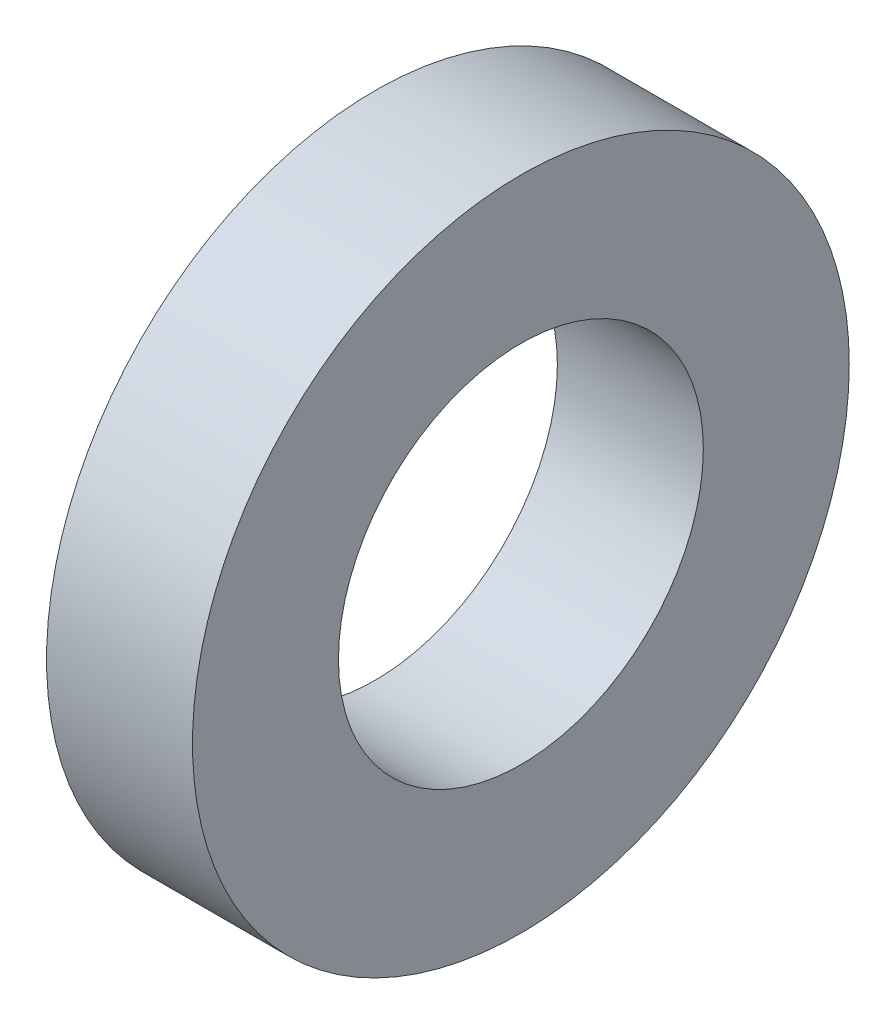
SolidWorks part; units mm, degrees
ref_plane "Face" through (0, 0, 0) normal (0, 0, 1) x (1, 0, 0)
ref_plane "Dessus" through (0, 0, 0) normal (0, 1, 0) x (1, 0, 0)
ref_plane "Droite" through (0, 0, 0) normal (1, 0, 0) x (0, 0, -1)
sketch "Esquisse1" plane through (0, 0, 0) normal (1, 0, 0) x (0, 0, -1)
  circle A0 centre (0, 0) radius 5
  circle A1 centre (0, 0) radius 9
  dimension "D1" = 10
  dimension "D2" = 18
extrude "Base-Extrusion" add sketch "Esquisse1" along normal blind 4
